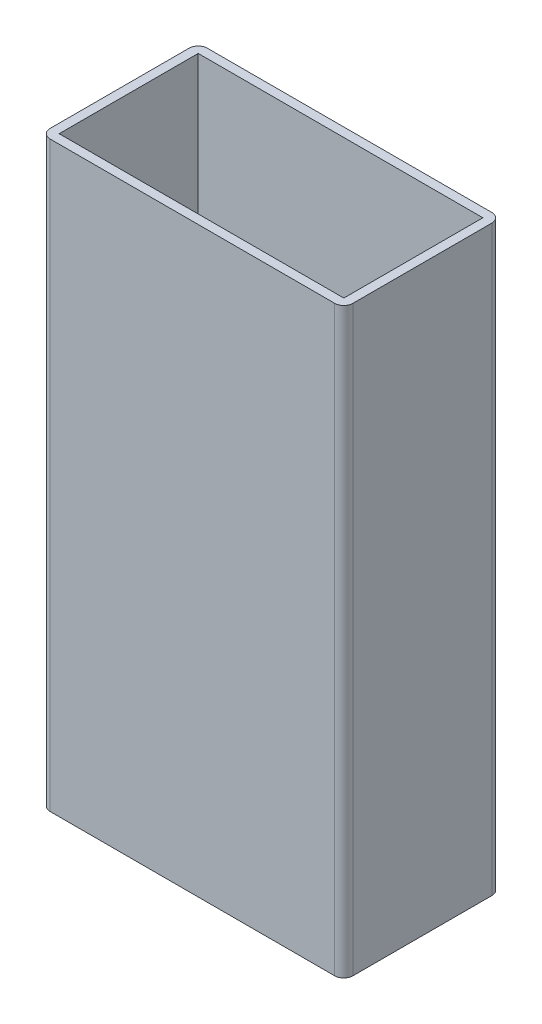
SolidWorks part; units mm, degrees
ref_plane "Front Plane" through (0, 0, 0) normal (0, 0, 1) x (1, 0, 0)
ref_plane "Top Plane" through (0, 0, 0) normal (0, 1, 0) x (1, 0, 0)
ref_plane "Right Plane" through (0, 0, 0) normal (1, 0, 0) x (0, 0, -1)
sketch "Sketch1" plane through (0, 0, 0) normal (0, 1, 0) x (1, 0, 0)
  line L1 (-24.8285, -13.716) -> (24.8285, -13.716)
  line L2 (-26.416, -12.1285) -> (-26.416, 12.1285)
  line L3 (-24.8285, 13.716) -> (24.8285, 13.716)
  line L4 (26.416, -12.1285) -> (26.416, 12.1285)
  line L5 (-26.416, -13.716) -> (26.416, 13.716) construction
  line L6 (-26.416, 13.716) -> (26.416, -13.716) construction
  arc A0 (-24.8285, -13.716) -> (-26.416, -12.1285) centre (-24.8285, -12.1285) cw
  arc A1 (24.8285, -13.716) -> (26.416, -12.1285) centre (24.8285, -12.1285) ccw
  arc A2 (24.8285, 13.716) -> (26.416, 12.1285) centre (24.8285, 12.1285) cw
  arc A3 (-26.416, 12.1285) -> (-24.8285, 13.716) centre (-24.8285, 12.1285) cw
  point P0 (0, 0)
  dimension "D3" = 1.5875
  dimension "D1" = 52.832
  dimension "D2" = 27.432
extrude "Extrude-Thin1" add sketch "Sketch1" along normal blind 101.6 thin
